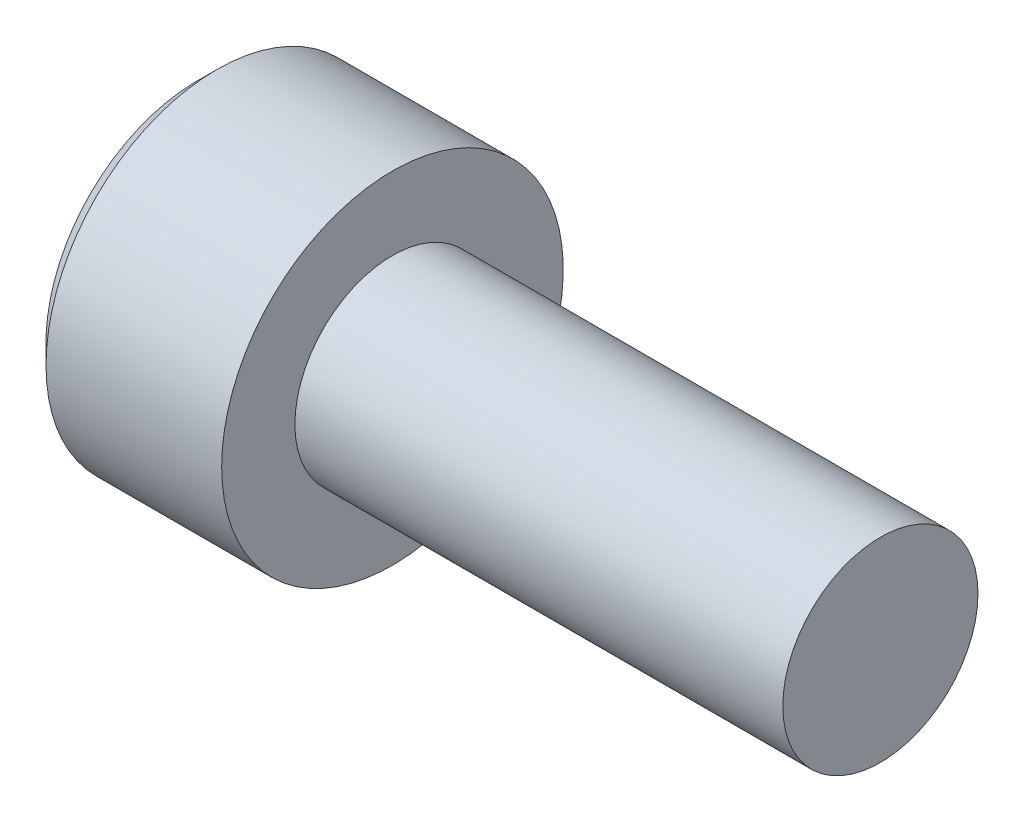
SolidWorks part; units mm, degrees
ref_plane "Front Plane" through (0, 0, 0) normal (0, 0, 1) x (1, 0, 0)
ref_plane "Top Plane" through (0, 0, 0) normal (0, 1, 0) x (1, 0, 0)
ref_plane "Right Plane" through (0, 0, 0) normal (1, 0, 0) x (0, 0, -1)
sketch "Sketch1" plane through (0, 0, 0) normal (0, 0, 1) x (1, 0, 0)
  line L2 (-4, 0) -> (10, 0)
  line L3 (10, 0) -> (10, 2)
  line L4 (10, 2) -> (0, 2)
  line L5 (0, 2) -> (0, 3.5)
  line L6 (0, 3.5) -> (-4, 3.5)
  line L7 (-4, 3.5) -> (-4, 0)
  line L8 (-4, 0) -> (10, 0) construction
  line L9 (0, 0) -> (0, 3.5) construction
  dimension "E" = 4
  dimension "L" = 10
  dimension "A" = 7
  dimension "M" = 4
revolve "Revolve1" add sketch "Sketch1" about L8
chamfer "Chamfer1" distance 0.4 1 edges at (-4, 0, 3.5)
sketch "Sketch2" plane through (0, 0, 0) normal (0, 0, 1) x (1, 0, 0)
  line L0 (-1.0987, 0) -> (-2, 1.5)
  line L1 (-4, 0) -> (10, 0) construction
  line L2 (-2, 1.5) -> (-4, 1.5)
  line L3 (-4, 3.5) -> (-4, 0) construction
  line L4 (-4, 1.5) -> (-4, 0)
  line L5 (-4, 0) -> (-1.0987, 0) construction
  line L6 (-1.0987, 0) -> (-4, 0)
  dimension "FIX_3" = 59
revolve "Cut-Revolve1" cut sketch "Sketch2" about L5
sketch "Sketch3" plane through (-4, 0, 0) normal (-1, 0, 0) x (0, 0, 1)
  line L0 (0, -1.7321) -> (0, 1.7321) construction
  line L1 (0, -1.7321) -> (1.5, -0.866)
  line L2 (1.5, -0.866) -> (1.5, 0.866)
  line L3 (1.5, 0.866) -> (0, 1.7321)
  line L4 (0, 1.7321) -> (-1.5, 0.866)
  line L5 (-1.5, 0.866) -> (-1.5, -0.866)
  line L6 (-1.5, -0.866) -> (0, -1.7321)
  line L7 (-1.5, 0) -> (1.5, 0) construction
  circle A0 centre (0, 0) radius 1.5 construction
extrude "Cut-Extrude1" cut sketch "Sketch3" against normal blind 2
